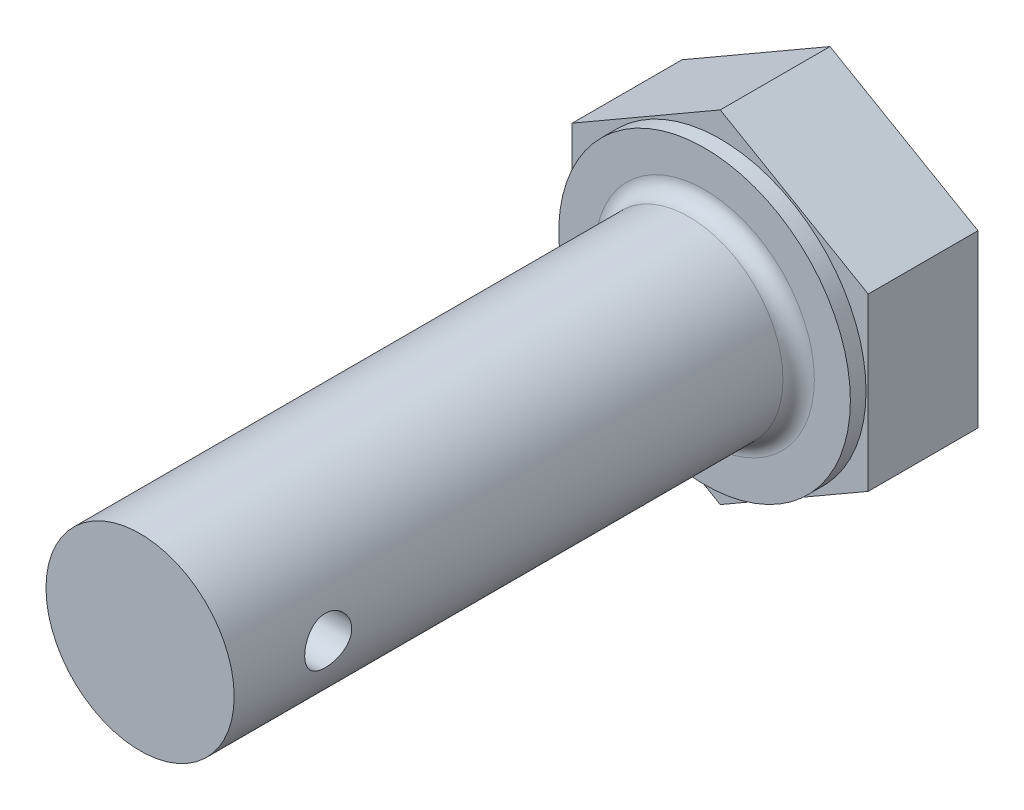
SolidWorks part; units mm, degrees
ref_plane "Ebene vorne" through (0, 0, 0) normal (0, 0, 1) x (1, 0, 0)
ref_plane "Ebene oben" through (0, 0, 0) normal (0, 1, 0) x (1, 0, 0)
ref_plane "Ebene rechts" through (0, 0, 0) normal (1, 0, 0) x (0, 0, -1)
sketch "Skizze1" plane through (0, 0, 0) normal (0, 0, 1) x (1, 0, 0)
  line L1 (-26.2234, 5.45) -> (-30.9432, 2.725)
  line L2 (-30.9432, 2.725) -> (-30.9432, -2.725)
  line L3 (-30.9432, -2.725) -> (-26.2234, -5.45)
  line L4 (-26.2234, -5.45) -> (-21.5036, -2.725)
  line L5 (-21.5036, -2.725) -> (-21.5036, 2.725)
  line L6 (-21.5036, 2.725) -> (-26.2234, 5.45)
  circle A0 centre (-26.2234, 0) radius 4.7198 construction
  dimension "D1" = 10.9
extrude "Linear austragen1" add sketch "Skizze1" along normal blind 3.5
sketch "Skizze2" plane through (0, 0, 3.5) normal (0, 0, 1) x (1, 0, 0)
  circle A0 centre (-26.2234, 0) radius 4.65
extrude "Linear austragen2" add sketch "Skizze2" along normal blind 0.5
sketch "Skizze3" plane through (0, 0, 4) normal (0, 0, 1) x (1, 0, 0)
  circle A0 centre (-26.2234, 0) radius 3
  dimension "D1" = 6
extrude "Linear austragen3" add sketch "Skizze3" along normal blind 18
sketch "Skizze10" plane through (0, 0, 22) normal (0, 0, 1) x (1, 0, 0)
  line L0 (-26.2234, 5.8381) -> (-26.2234, -5.9997) construction
  line L1 (-30.9432, 0) -> (-21.5036, 0) construction
  line L2 (-21.5036, -2.725) -> (-21.5036, 2.725) construction
  line L3 (-30.9432, 2.725) -> (-30.9432, -2.725) construction
hole_wizard "Ø1.5 (1.5) Durchmesser Bohrung1" positions "Skizze12" profile "Skizze11" hole size "Ø1.5" standard "DIN"
sketch "Skizze12" plane through (-21.5036, 0, 0) normal (1, 0, 0) x (0, 0, -1)
  line L0 (0, 0) -> (-19, 0) construction
  line L1 (0, -2.725) -> (0, 2.725) construction
  line L4 (-22, 3) -> (-22, -3) construction
  point P0 (-19, 0)
  dimension "D1" = 3
sketch "Skizze11" plane through (-21.5036, 0, 19) normal (0, 1, 0) x (0, 0, -1)
  line L0 (0, 0) -> (0, 9.4397)
  line L1 (0, 9.4397) -> (0.75, 9.4397)
  line L2 (0.75, 9.4397) -> (0.75, 0)
  line L5 (0.75, 0) -> (0, 0)
  line L11 (0, -6.35) -> (0, 107.95) construction
  dimension "Bohrerdurchmesser" = 1.5
  dimension "Bohrungstiefe" = 9.4397
fillet "Verrundung1" radius 0.5 1 edges at (-23.2234, 0, 4)
